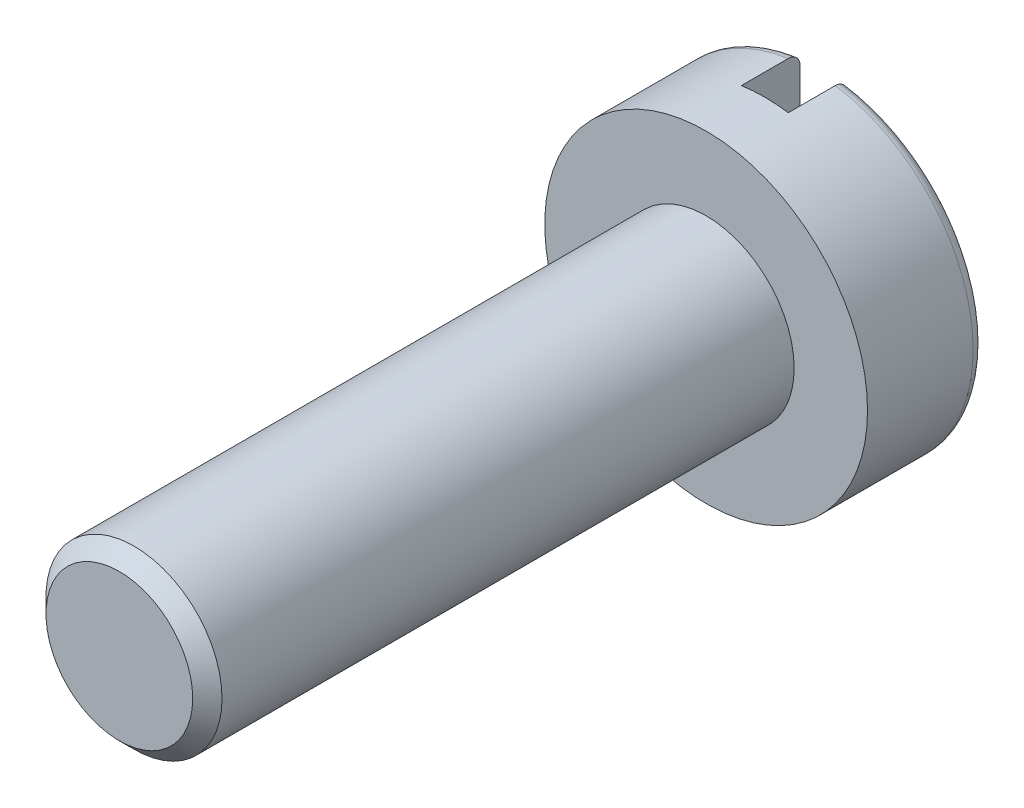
SolidWorks part; units mm, degrees
ref_plane "Plan1" through (0, 0, 0) normal (0, 0, 1) x (1, 0, 0)
ref_plane "Plan2" through (0, 0, 0) normal (0, 1, 0) x (1, 0, 0)
ref_plane "Plan3" through (0, 0, 0) normal (1, 0, 0) x (0, 0, -1)
sketch "Esquisse1" plane through (0, 0, 0) normal (0, 0, 1) x (1, 0, 0)
  circle A0 centre (0, 0) radius 2.75
  dimension "D1" = 5.5
extrude "Base-Extrusion" add sketch "Esquisse1" against normal blind 2
sketch "Esquisse2" plane through (0, 0, 0) normal (0, 0, 1) x (1, 0, 0)
  circle A0 centre (0, 0) radius 1.5
  dimension "D1" = 3
extrude "Boss.-Extru.1" add sketch "Esquisse2" along normal blind 10
chamfer "Chanfrein1" distance 0.25 angle 45
fillet "Congé1" radius 0.2
sketch "Esquisse3" plane through (0, 0, -2) normal (0, 0, -1) x (-1, 0, 0)
  line L0 (0, 2) -> (0, -3) construction
  line L1 (-0.4, 2.75) -> (0.4, 2.75)
  line L2 (-0.4, 2.75) -> (-0.4, -2.75)
  line L3 (-0.4, -2.75) -> (0.4, -2.75)
  line L4 (0.4, 2.75) -> (0.4, -2.75)
  circle A0 centre (0, 0) radius 2.75 construction
  dimension "D1" = 0.8
extrude "Enlèv. mat.-Extru.1" cut sketch "Esquisse3" against normal blind 1
